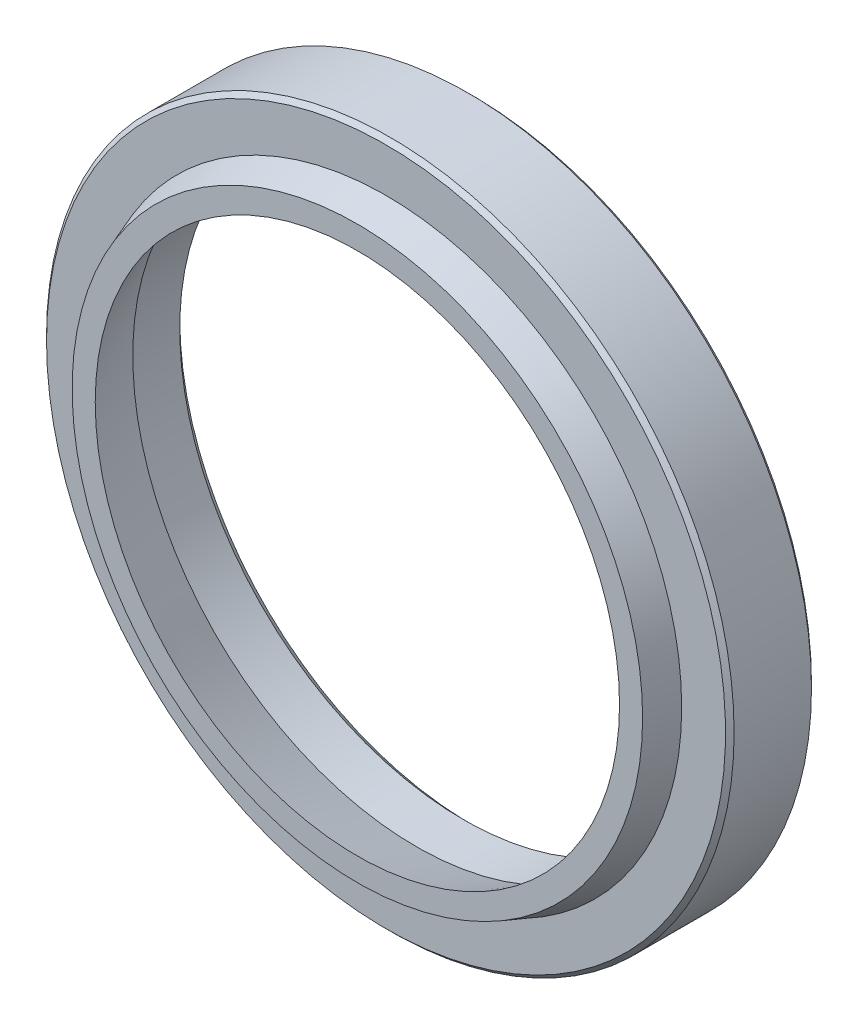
SolidWorks part; units mm, degrees
ref_plane "Front" through (0, 0, 0) normal (0, 0, 1) x (1, 0, 0)
ref_plane "Top" through (0, 0, 0) normal (0, 1, 0) x (1, 0, 0)
ref_plane "Right" through (0, 0, 0) normal (1, 0, 0) x (0, 0, -1)
sketch "Sketch1" plane through (0, 0, 0) normal (0, 1, 0) x (-1, 0, 0)
  line L0 (0, 9.1959) -> (0, -4.6797) construction
  line L1 (16.5, -6.6667) -> (16.5, -3.4343)
  line L2 (16.5, -6.6667) -> (20, -6.6667)
  line L3 (16.5, -3.4343) -> (15.25, 0)
  line L4 (17.2, -1.6667) -> (20, -1.6667)
  line L5 (20, -6.6667) -> (20, -1.6667)
  line L6 (15.25, 0) -> (16.5934, 0)
  line L7 (16.5934, 0) -> (17.2, -1.6667)
  dimension "D1" = 30.5
  dimension "h" = 5
  dimension "D" = 40
  dimension "S" = 3.5
  dimension "D5" = 160
  dimension "D6" = 0.7
  dimension "D7" = 1.6667
revolve "Body" add sketch "Sketch1" angle 360 about L0
chamfer "EndChamfer" distance 0.5 angle 45 1 edges at (16.5, 0, -6.6667)
chamfer "BodyChamfer" distance 0.25 angle 45 2 edges at (20, 0, -1.6667) (20, 0, -6.6667)
equation "\"D7@Sketch1\" = \"h@Sketch1\" / 3"
equation "\"D6@Sketch1\" = \"S@Sketch1\" / 5"
equation "\"D1@EndChamfer\" = \"S@Sketch1\" / 7"
equation "\"D1@BodyChamfer\" = \"S@Sketch1\" / 14"
